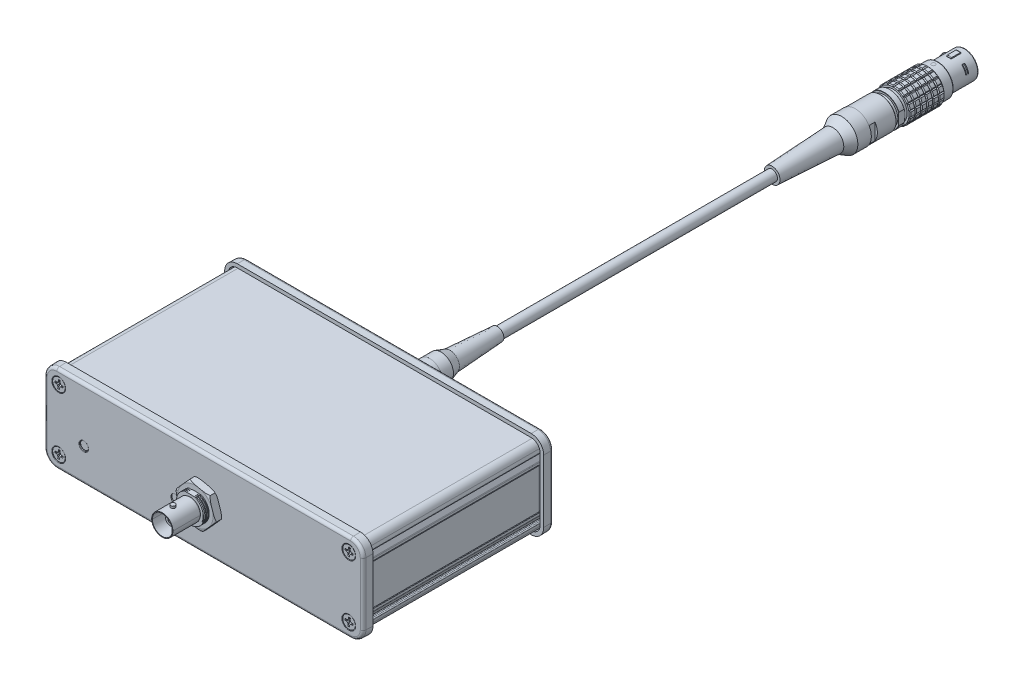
SolidWorks part; units mm, degrees
ref_plane "Front Plane" through (0, 0, 0) normal (0, 0, 1) x (1, 0, 0)
ref_plane "Top Plane" through (0, 0, 0) normal (0, 1, 0) x (1, 0, 0)
ref_plane "Right Plane" through (0, 0, 0) normal (1, 0, 0) x (0, 0, -1)
imported_body "107-557-3-solid1"
imported_body "131-557-1-solid1"
imported_body "107-548-XX-9/107-548-1-solid1"
imported_body "112-814-9/107-549-1/107-549-DET-01-1-solid1"
imported_body "112-814-9/107-549-1/107-549-DET-02-1-solid1"
imported_body "112-814-9/110-924-1-surface1"
imported_body "112-814-9/110-924-1-surface2"
imported_body "112-814-9/110-924-1-surface3"
imported_body "112-814-9/110-927-1-solid1"
imported_body "112-814-9/110-926-1-solid1"
imported_body "112-814-9/110-925-1-solid1"
imported_body "112-814-9/W-231^112-814-1-solid1"
imported_body "surface42"
imported_body "surface43"
imported_body "surface44"
imported_body "surface45"
imported_body "surface46"
imported_body "surface47"
imported_body "surface68"
imported_body "surface69"
imported_body "surface70"
imported_body "surface71"
imported_body "surface72"
imported_body "surface73"
imported_body "0-195-3-solid1"
imported_body "M3 FLAT HEAD PHILLIPS SCREW-1-solid1"
imported_body "M3 FLAT HEAD PHILLIPS SCREW-2-solid1"
imported_body "M3 FLAT HEAD PHILLIPS SCREW-3-solid1"
imported_body "M3 FLAT HEAD PHILLIPS SCREW-4-solid1"
imported_body "M3 FLAT HEAD PHILLIPS SCREW-5-solid1"
imported_body "M3 FLAT HEAD PHILLIPS SCREW-6-solid1"
imported_body "M3 FLAT HEAD PHILLIPS SCREW-7-solid1"
imported_body "M3 FLAT HEAD PHILLIPS SCREW-8-solid1"
imported_body "131-557-2-solid1"
surface "Surface-Plane1"
surface "Surface-Plane2"
surface "Surface-Plane5"
surface "Surface-Plane6"
